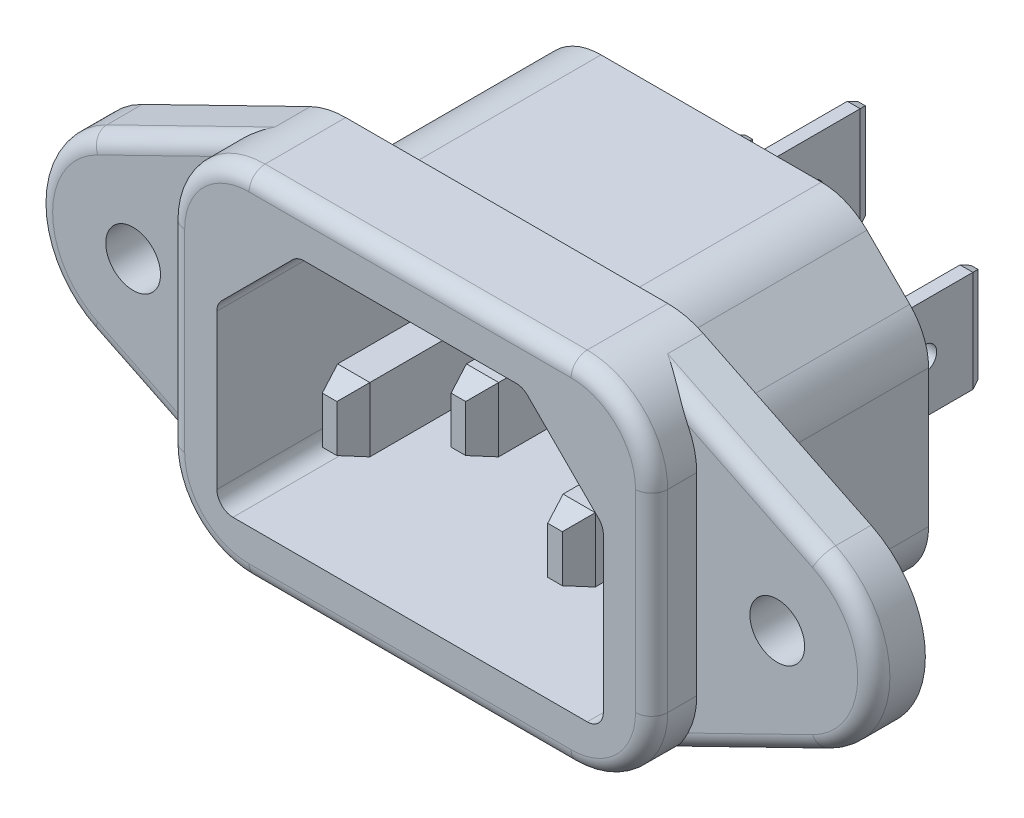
SolidWorks part; units mm, degrees
ref_plane "Front" through (0, 0, 0) normal (0, 0, 1) x (1, 0, 0)
ref_plane "Top" through (0, 0, 0) normal (0, 1, 0) x (1, 0, 0)
ref_plane "Right" through (0, 0, 0) normal (1, 0, 0) x (0, 0, -1)
sketch "Sketch1" plane through (0, 0, 0) normal (0, 0, 1) x (1, 0, 0)
  line L1 (10, 11) -> (-10, 11)
  line L2 (15, 6) -> (15, -6)
  line L3 (10, -11) -> (-10, -11)
  line L4 (-15, 6) -> (-15, -6)
  line L5 (15, 11) -> (-15, -11) construction
  line L6 (15, -11) -> (-15, 11) construction
  arc A0 (15, -6) -> (10, -11) centre (10, -6) cw
  arc A1 (10, 11) -> (15, 6) centre (10, 6) cw
  arc A2 (-10, 11) -> (-15, 6) centre (-10, 6) ccw
  arc A3 (-10, -11) -> (-15, -6) centre (-10, -6) cw
  point P0 (0, 0)
  dimension "D3" = 5
  dimension "D1" = 22
  dimension "D2" = 30
extrude "C14 Entry Front" add sketch "Sketch1" along normal blind 6
sketch "Sketch2" plane through (0, 0, 0) normal (0, 0, 1) x (1, 0, 0)
  line L0 (-20, 0) -> (20, 0) construction
  line L1 (-12.1954, 10.4923) -> (-22.6344, 5.3907)
  line L2 (-22.6344, -5.3907) -> (-12.1954, -10.4923)
  line L3 (12.1954, -10.4923) -> (22.6344, -5.3907)
  line L4 (12.1954, 10.4923) -> (22.6344, 5.3907)
  line L9 (15, -6) -> (15, 6)
  line L10 (10, 11) -> (-10, 11)
  line L11 (-15, 6) -> (-15, -6)
  line L12 (-10, -11) -> (10, -11)
  line L14 (10, 11) -> (-10, 11)
  line L16 (-10, -11) -> (10, -11)
  arc A0 (-22.6344, 5.3907) -> (-22.6344, -5.3907) centre (-20, 0) ccw
  arc A1 (22.6344, -5.3907) -> (22.6344, 5.3907) centre (20, 0) ccw
  arc A2 (-15, -6) -> (-10, -11) centre (-10, -6) ccw construction
  arc A3 (-10, 11) -> (-15, 6) centre (-10, 6) ccw construction
  arc A4 (15, 6) -> (10, 11) centre (10, 6) ccw construction
  arc A5 (10, -11) -> (15, -6) centre (10, -6) ccw construction
  arc A10 (10, -11) -> (15, -6) centre (10, -6) ccw
  arc A11 (15, 6) -> (10, 11) centre (10, 6) ccw
  arc A12 (-10, 11) -> (-15, 6) centre (-10, 6) ccw
  arc A13 (-15, -6) -> (-10, -11) centre (-10, -6) ccw
  arc A14 (10, -11) -> (12.1954, -10.4923) centre (10, -6) ccw
  arc A15 (12.1954, 10.4923) -> (10, 11) centre (10, 6) ccw
  arc A16 (-10, 11) -> (-12.1954, 10.4923) centre (-10, 6) ccw
  arc A17 (-12.1954, -10.4923) -> (-10, -11) centre (-10, -6) ccw
  point P2 (0, 0)
  dimension "D2" = 12
  dimension "D1" = 40
  dimension "D3" = 0
extrude "Panel Mount Flange" add sketch "Sketch2" along normal blind 3.2
fillet "Entry Fillets" radius 1 14 edges at (17.4149, 7.9415, 3.2) (26, 0, 3.2) (-15, 0, 6) (-13.5355, 9.5355, 6) (0, 11, 6) (13.5355, 9.5355, 6) (15, 0, 6) (13.5355, -9.5355, 6) (0, -11, 6) (-17.4149, 7.9415, 3.2) (-17.4149, -7.9415, 3.2) (17.4149, -7.9415, 3.2) (-13.5355, -9.5355, 6) (-26, 0, 3.2)
sketch "Sketch3" plane through (0, 0, 3.2) normal (0, 0, 1) x (1, 0, 0)
  line L0 (-20, 0) -> (20, 0) construction
  circle A0 centre (-20, 0) radius 1.7
  circle A1 centre (20, 0) radius 1.7
  point P2 (0, 0)
  dimension "D2" = 3.4
  dimension "D1" = 40
extrude "Screw Mount Holes" cut sketch "Sketch3" against normal through all
sketch "Sketch4" plane through (0, 0, 0) normal (0, 0, -1) x (-1, 0, 0)
  line L0 (-6.8431, 9.6) -> (6.8431, 9.6)
  line L1 (9.6716, 8.4284) -> (12.3284, 5.7716)
  line L2 (13.5, 2.9431) -> (13.5, -5.6)
  line L3 (9.5, -9.6) -> (-9.5, -9.6)
  line L4 (-13.5, -5.6) -> (-13.5, 2.9431)
  line L5 (-12.3284, 5.7716) -> (-9.6716, 8.4284)
  line L6 (0, 9.6) -> (0, -9.6) construction
  arc A0 (-13.5, 2.9431) -> (-12.3284, 5.7716) centre (-9.5, 2.9431) cw
  arc A1 (-6.8431, 9.6) -> (-9.6716, 8.4284) centre (-6.8431, 5.6) ccw
  arc A2 (6.8431, 9.6) -> (9.6716, 8.4284) centre (6.8431, 5.6) cw
  arc A3 (12.3284, 5.7716) -> (13.5, 2.9431) centre (9.5, 2.9431) cw
  arc A4 (13.5, -5.6) -> (9.5, -9.6) centre (9.5, -5.6) cw
  arc A5 (-9.5, -9.6) -> (-13.5, -5.6) centre (-9.5, -5.6) cw
  point P8 (0, 0)
  point P14 (-8.5, 9.6)
  point P17 (8.5, 9.6)
  point P22 (13.5, -9.6)
  point P25 (-13.5, -9.6)
  dimension "D5" = 4
  dimension "D1" = 27
  dimension "D2" = 19.2
  dimension "D3" = 45
  dimension "D4" = 17
extrude "C14 Body" add sketch "Sketch4" along normal blind 12.7
sketch "Sketch5" plane through (0, 0, 6) normal (0, 0, 1) x (1, 0, 0)
  line L0 (-6.5858, 8) -> (6.5858, 8)
  line L1 (7.2929, 7.7071) -> (11.7071, 3.2929)
  line L2 (12, 2.5858) -> (12, -7)
  line L3 (11, -8) -> (-11, -8)
  line L4 (-12, -7) -> (-12, 2.5858)
  line L5 (-11.7071, 3.2929) -> (-7.2929, 7.7071)
  line L6 (0, 8) -> (0, -8) construction
  arc A0 (6.5858, 8) -> (7.2929, 7.7071) centre (6.5858, 7) cw
  arc A1 (11.7071, 3.2929) -> (12, 2.5858) centre (11, 2.5858) cw
  arc A2 (12, -7) -> (11, -8) centre (11, -7) cw
  arc A3 (-11, -8) -> (-12, -7) centre (-11, -7) cw
  arc A4 (-12, 2.5858) -> (-11.7071, 3.2929) centre (-11, 2.5858) cw
  arc A5 (-6.5858, 8) -> (-7.2929, 7.7071) centre (-6.5858, 7) ccw
  point P8 (0, 0)
  point P12 (7, 8)
  point P23 (-7, 8)
  dimension "D5" = 1
  dimension "D1" = 45
  dimension "D2" = 16
  dimension "D3" = 24
  dimension "D4" = 14
extrude "C14 Recpt" cut sketch "Sketch5" against normal blind 17
sketch "Sketch7" plane through (0, 0, -11) normal (0, 0, 1) x (1, 0, 0)
  line L1 (-6, 0) -> (-8, 0)
  line L2 (-6, 0) -> (-6, -4)
  line L3 (-6, -4) -> (-8, -4)
  line L4 (-8, 0) -> (-8, -4)
  line L5 (-6, 0) -> (-8, -4) construction
  line L6 (-6, -4) -> (-8, 0) construction
  point P0 (-7, -2)
  dimension "D1" = 2
  dimension "D2" = 7
  dimension "D3" = 2
  dimension "D4" = 4
extrude "Terminal Blade C14" add sketch "Sketch7" along normal blind 15 separate body
sketch "Sketch8" plane through (0, 0, -11) normal (0, 0, -1) x (-1, 0, 0)
  line L0 (6, 0) -> (8, 0) construction
  line L1 (6, 1) -> (8, 1)
  line L2 (6, 1) -> (6, -7.3)
  line L3 (6, -7.3) -> (8, -7.3)
  line L4 (8, 1) -> (8, -7.3)
  line L5 (8, 0) -> (8, -4) construction
  line L6 (6, -4) -> (6, 0) construction
  dimension "D1" = 1
  dimension "D2" = 7.3
extrude "Terminal Blade Trans" add sketch "Sketch8" along normal blind 3.7
sketch "Sketch9" plane through (0, 0, -14.7) normal (0, 0, -1) x (-1, 0, 0)
  line L0 (8, -7.3) -> (8, 1) construction
  line L1 (8, 0) -> (7.2, 0)
  line L2 (8, 0) -> (8, -6.3)
  line L3 (8, -6.3) -> (7.2, -6.3)
  line L4 (7.2, 0) -> (7.2, -6.3)
  line L5 (6, -3.15) -> (7.2, -3.15) construction
  line L6 (6, 1) -> (6, -7.3) construction
  dimension "D1" = 0.8
  dimension "D2" = 6.3
extrude "Terminal 6.3 Tab" add sketch "Sketch9" along normal blind 7.95
sketch "Sketch10" plane through (-6, 0, 0) normal (1, 0, 0) x (0, 0, -1)
  line L0 (13.15, -3.15) -> (19.15, -3.15) construction
  line L1 (14.7, 0) -> (14.7, -6.3) construction
  line L3 (22.65, 0) -> (22.65, -6.3) construction
  circle A0 centre (13.15, -3.15) radius 0.75
  circle A1 centre (19.15, -3.15) radius 0.75
  point P4 (14.7, -3.15)
  point P7 (0, 0)
  point P8 (12.9199, -3.15)
  point P10 (19.4999, -3.15)
  point P13 (0, 0)
  dimension "D2" = 1.5
  dimension "D1" = 3.5
  dimension "D3" = 6
extrude "Terminal Blade Holes" cut sketch "Sketch10" against normal blind 3
chamfer "6.3 Tab Chamfer" distance 0.5 angle 20 4 edges at (-7.6, -6.3, -22.65) (-7.2, -3.15, -22.65) (-7.6, 0, -22.65) (-8, -3.15, -22.65)
chamfer "C14 Terminal Blade Chamfer" distance 1.5 angle 20 4 edges at (-7, 0, 4) (-6, -2, 4) (-7, -4, 4) (-8, -2, 4)
sketch "Sketch12" plane through (-6, 0, 0) normal (1, 0, 0) x (0, 0, -1)
  line L0 (14.7, -7.3) -> (11, -7.3) construction
  line L1 (14.7, 1) -> (12, 1)
  line L2 (14.7, 1) -> (14.7, -7.3)
  line L3 (14.7, -7.3) -> (12, -7.3)
  line L4 (12, 1) -> (12, -7.3)
  line L5 (11, -4) -> (11, -7.3) construction
  point P9 (11, -5.65)
  dimension "D1" = 1
extrude "Terminal Blade Thin Cut" cut sketch "Sketch12" against normal blind 1.2
sketch "Sketch11" plane through (0, 0, -12.7) normal (0, 0, -1) x (-1, 0, 0)
  line L0 (8, 1) -> (7.2, 1) construction
  line L1 (8, 2) -> (6, 2)
  line L2 (9, 1) -> (9, -7.3)
  line L3 (8, -8.3) -> (6, -8.3)
  line L4 (5, 1) -> (5, -7.3)
  line L5 (9, 2) -> (5, -8.3) construction
  line L6 (9, -8.3) -> (5, 2) construction
  line L7 (7.2, -7.3) -> (8, -7.3) construction
  line L8 (8, 0) -> (8, 1) construction
  arc A0 (6, 2) -> (5, 1) centre (6, 1) ccw
  arc A1 (8, 2) -> (9, 1) centre (8, 1) cw
  arc A2 (9, -7.3) -> (8, -8.3) centre (8, -7.3) cw
  arc A3 (6, -8.3) -> (5, -7.3) centre (6, -7.3) cw
  point P0 (7, -3.15)
  point P5 (2.9572, -2.8336)
  dimension "D5" = 1
  dimension "D1" = 1
  dimension "D2" = 7
  dimension "D3" = 1
  dimension "D4" = 1
extrude "6.3 Tab Body Boss" add sketch "Sketch11" along normal offset from surface (1 mm away) 13.7
pattern_linear "Terminal Blade Pattern" count 2 spacing 14 along (1, 0, 0)
sketch "Sketch13" plane through (0, 0, -11) normal (0, 0, 1) x (1, 0, 0)
  line L0 (-1, -1) -> (1, -1) construction
  line L1 (-1, 6.3) -> (1, 6.3)
  line L2 (-1, 6.3) -> (-1, -2)
  line L3 (-1, -2) -> (1, -2)
  line L4 (1, 6.3) -> (1, -2)
  line L5 (-1, 3) -> (1, 3) construction
  line L6 (0, 3) -> (0, -1) construction
  point P4 (0, -2)
  point P12 (0, 1)
  dimension "D1" = 8.3
  dimension "D2" = 2
  dimension "D3" = 4
  dimension "D4" = 1
  dimension "D5" = 1
extrude "Terminal Blade Mid Base" add sketch "Sketch13" against normal blind 1 separate body
sketch "Sketch14" plane through (0, 0, -11) normal (0, 0, 1) x (1, 0, 0)
  line L0 (-1, 6.3) -> (-1, -2) construction
  line L1 (-1, -1) -> (1, -1)
  line L2 (-1, -1) -> (-1, 3)
  line L3 (-1, 3) -> (1, 3)
  line L4 (1, -1) -> (1, 3)
  line L5 (1, -2) -> (1, 6.3) construction
  line L6 (-1, -2) -> (1, -2) construction
  dimension "D1" = 4
  dimension "D2" = 1
extrude "Terminal Blade Mid" add sketch "Sketch14" along normal blind 14
chamfer "Terminal Blade Mid Chamfer" distance 1.5 angle 20 4 edges at (0, 3, 3) (1, 1, 3) (0, -1, 3) (-1, 1, 3)
sketch "Sketch15" plane through (-1, 0, 0) normal (-1, 0, 0) x (0, 0, 1)
  line L0 (-12, -2) -> (-11, -2) construction
  line L1 (-12, 6.3) -> (-14.7, 6.3)
  line L2 (-12, 6.3) -> (-12, -2)
  line L3 (-12, -2) -> (-14.7, -2)
  line L4 (-14.7, 6.3) -> (-14.7, -2)
  dimension "D1" = 2.7
extrude "Terminal Blade Mid Tans" add sketch "Sketch15" against normal blind 0.8
sketch "Sketch16" plane through (-0.2, 0, 0) normal (1, 0, 0) x (0, 0, -1)
  line L0 (14.7, 6.3) -> (14.7, -2) construction
  line L1 (14.7, 5.3) -> (22.65, 5.3)
  line L2 (14.7, 5.3) -> (14.7, -1)
  line L3 (14.7, -1) -> (22.65, -1)
  line L4 (22.65, 5.3) -> (22.65, -1)
  line L5 (22.65, 2.15) -> (14.7, 2.15) construction
  point P8 (14.7, 2.15)
  dimension "D1" = 6.3
  dimension "D2" = 7.95
extrude "6.3 Mid Tab" add sketch "Sketch16" against normal blind 0.8
chamfer "6.3 Mid Tab Chamfer" distance 0.5 angle 20 4 edges at (-0.6, 5.3, -22.65) (-0.2, 2.15, -22.65) (-1, 2.15, -22.65) (-0.6, -1, -22.65)
sketch "Sketch17" plane through (-0.2, 0, 0) normal (1, 0, 0) x (0, 0, -1)
  line L0 (13.15, 2.15) -> (19.15, 2.15) construction
  line L1 (22.65, 5.118) -> (22.65, -0.818) construction
  line L2 (22.15, -1) -> (22.15, 5.3) construction
  circle A0 centre (19.15, 2.15) radius 0.75
  circle A1 centre (13.15, 2.15) radius 0.75
  point P8 (22.15, 2.15)
  dimension "D1" = 1.5
  dimension "D2" = 3.5
  dimension "D3" = 6
extrude "6.3 Mid Tab Holes" cut sketch "Sketch17" against normal blind 0.8
sketch "Sketch18" plane through (0, 0, -12.7) normal (0, 0, -1) x (-1, 0, 0)
  line L0 (1, 6.3) -> (1, 5.3) construction
  line L1 (-1, 7.3) -> (1, 7.3)
  line L2 (-2, 6.3) -> (-2, -2)
  line L3 (-1, -3) -> (1, -3)
  line L4 (2, 6.3) -> (2, -2)
  line L5 (-8, 2) -> (-6, 2)
  line L6 (-9, 1) -> (-9, -7.3)
  line L7 (-8, -8.3) -> (-6, -8.3)
  line L8 (-5, 1) -> (-5, -7.3)
  line L9 (-1, -2) -> (-1, 6.3) construction
  line L10 (-1, 6.3) -> (0.2, 6.3) construction
  line L11 (0.2, -2) -> (-1, -2) construction
  line L12 (-6.8, 1) -> (-8, 1) construction
  line L13 (-6.8, -7.3) -> (-8, -7.3) construction
  line L14 (-8, 1) -> (-8, -7.3) construction
  line L15 (-6, -7.3) -> (-6, -6.3) construction
  arc A0 (1, -3) -> (2, -2) centre (1, -2) ccw
  arc A1 (1, 7.3) -> (2, 6.3) centre (1, 6.3) cw
  arc A2 (-1, 7.3) -> (-2, 6.3) centre (-1, 6.3) ccw
  arc A3 (-2, -2) -> (-1, -3) centre (-1, -2) ccw
  arc A4 (-9, -7.3) -> (-8, -8.3) centre (-8, -7.3) ccw
  arc A5 (-6, -8.3) -> (-5, -7.3) centre (-6, -7.3) ccw
  arc A6 (-6, 2) -> (-5, 1) centre (-6, 1) cw
  arc A7 (-8, 2) -> (-9, 1) centre (-8, 1) ccw
  point P30 (-0.4, 6.3)
  point P31 (0, 7.3)
  point P42 (-6, -6.8)
  dimension "D1" = 1
  dimension "D2" = 1
  dimension "D3" = 1
  dimension "D4" = 1
  dimension "D5" = 1
  dimension "D6" = 1
  dimension "D7" = 1
  dimension "D8" = 1
  dimension "D9" = 1
extrude "Body Tab Bosses" add sketch "Sketch18" along normal up to surface (1 mm away)
sketch "Front Panel Cutout" plane through (0, 0, 0) normal (0, 0, -1) x (-1, 0, 0)
  line L0 (-20, 0) -> (20, 0) construction
  line L1 (-9, 10) -> (9, 10)
  line L2 (-14, 5) -> (-14, -6)
  line L3 (-10, -10) -> (10, -10)
  line L4 (14, 5) -> (14, -6)
  line L5 (0, 10) -> (0, -10) construction
  line L6 (-14, 5) -> (-9, 10)
  line L7 (9, 10) -> (14, 5)
  arc A0 (10, -10) -> (14, -6) centre (10, -6) ccw
  arc A1 (-14, -6) -> (-10, -10) centre (-10, -6) ccw
  circle A2 centre (-20, 0) radius 1.7
  circle A3 centre (20, 0) radius 1.7
  point P0 (-14, 10)
  point P3 (14, 10)
  point P6 (0, 0)
  point P10 (0, 0)
  point P17 (14, -10)
  point P20 (-14, -10)
  dimension "D7" = 4
  dimension "D8" = 40
  dimension "D9" = 3.4
  dimension "D1" = 20
  dimension "D2" = 28
  dimension "D3" = 5
  dimension "D4" = 45
  dimension "D5" = 5
  dimension "D6" = 45
sketch "Rear Panel Cutout" plane through (0, 0, 3.2) normal (0, 0, 1) x (1, 0, 0)
  line L0 (-20, 0) -> (20, 0) construction
  line L1 (-10.15, 11.15) -> (10.15, 11.15)
  line L2 (-15.15, 6.15) -> (-15.15, -6.15)
  line L3 (-10.15, -11.15) -> (10.15, -11.15)
  line L4 (15.15, 6.15) -> (15.15, -6.15)
  line L5 (0, 11.15) -> (0, -11.15) construction
  circle A0 centre (-20, 0) radius 1.7
  circle A1 centre (20, 0) radius 1.7
  arc A2 (10.15, 11.15) -> (15.15, 6.15) centre (10.15, 6.15) cw
  arc A3 (-10.15, 11.15) -> (-15.15, 6.15) centre (-10.15, 6.15) ccw
  arc A4 (-15.15, -6.15) -> (-10.15, -11.15) centre (-10.15, -6.15) ccw
  arc A5 (10.15, -11.15) -> (15.15, -6.15) centre (10.15, -6.15) ccw
  point P10 (15.15, 11.15)
  point P13 (-15.15, 11.15)
  point P18 (15.15, -11.15)
  point P21 (0, 0)
  dimension "D1" = 40
  dimension "D2" = 3.4
  dimension "D5" = 5
  dimension "D3" = 30.3
  dimension "D4" = 22.3
